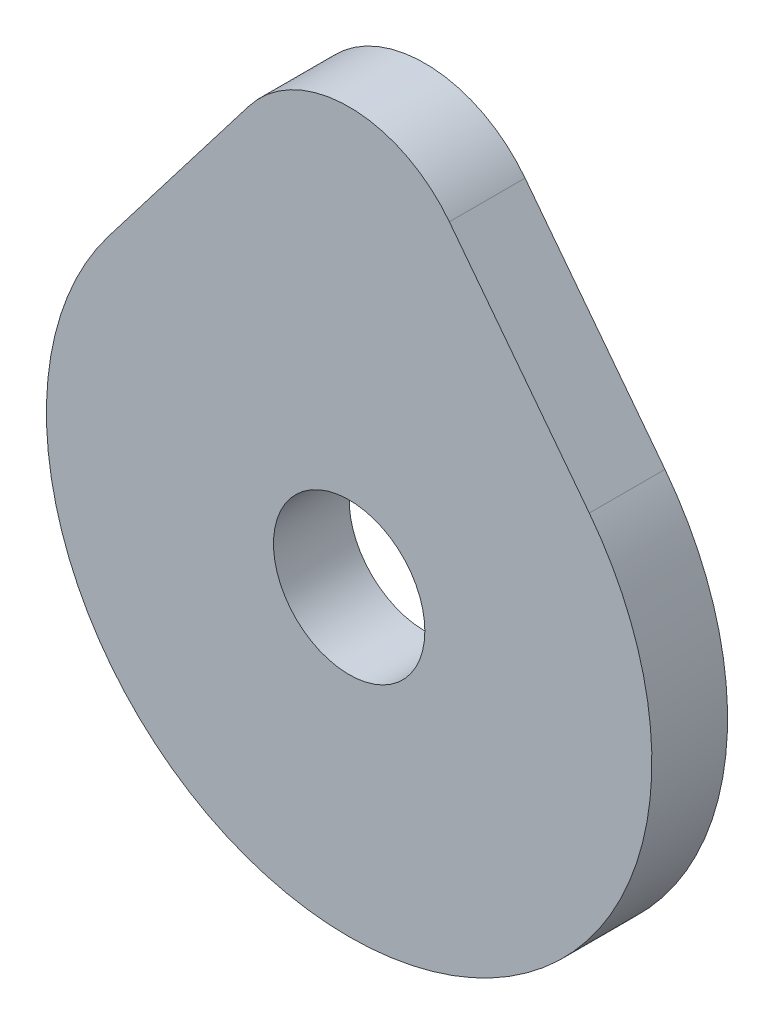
SolidWorks part; units mm, degrees
ref_plane "Front Plane" through (0, 0, 0) normal (0, 0, 1) x (1, 0, 0)
ref_plane "Top Plane" through (0, 0, 0) normal (0, 1, 0) x (1, 0, 0)
ref_plane "Right Plane" through (0, 0, 0) normal (1, 0, 0) x (0, 0, -1)
sketch "Sketch1" plane through (0, 0, 0) normal (0, 0, 1) x (1, 0, 0)
  line L0 (0, 0) -> (0, 3.175) construction
  line L1 (-4.2036, 15.3809) -> (-10.0742, 7.7331)
  line L2 (4.2036, 15.3809) -> (10.0742, 7.7331)
  circle A0 centre (0, 0) radius 3.175
  arc A2 (4.2036, 15.3809) -> (-4.2036, 15.3809) centre (0, 12.1542) ccw
  arc A4 (-10.0742, 7.7331) -> (10.0742, 7.7331) centre (0, 0) ccw
extrude "Boss-Extrude1" add sketch "Sketch1" along normal blind 3.175
